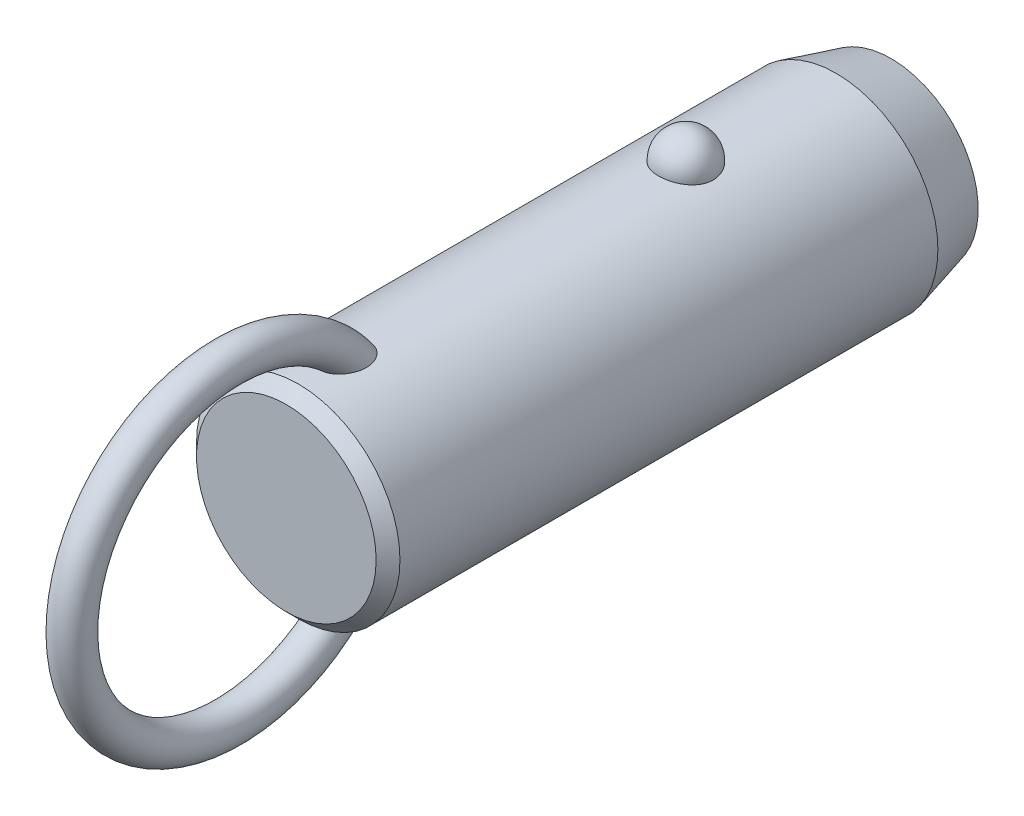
SolidWorks part; units mm, degrees
ref_plane "Front Plane" through (0, 0, 0) normal (0, 0, 1) x (1, 0, 0)
ref_plane "Top Plane" through (0, 0, 0) normal (0, 1, 0) x (1, 0, 0)
ref_plane "Right Plane" through (0, 0, 0) normal (1, 0, 0) x (0, 0, -1)
sketch "Sketch2" plane through (0, 0, 0) normal (0, 0, 1) x (1, 0, 0)
  circle A0 centre (0, 0) radius 11.1
  point P3 (0, 11.1)
  dimension "D1" = 22.2
extrude "Boss-Extrude1" add sketch "Sketch2" along normal blind 27.9
sketch "Sketch3" plane through (0, 0, 0) normal (0, 0, -1) x (-1, 0, 0)
  circle A0 centre (0, 0) radius 11.1
  dimension "D1" = 22.2
extrude "Boss-Extrude2" add sketch "Sketch3" along normal blind 25.4
chamfer "Chamfer1" distance 6 angle 15 1 edges at (-11.1, 0, -25.4)
sketch "Sketch12" plane through (0, 0, 0) normal (1, 0, 0) x (0, 0, -1)
  line L0 (-27.9, 11.1) -> (-27.9, -11.1) construction
  point P0 (-27.9, 0)
sketch "Sketch13" plane through (0, 0, 0) normal (1, 0, 0) x (0, 0, -1)
  circle A0 centre (-46.95, 0) radius 19.05
  point P2 (-27.9, 0)
  dimension "D1" = 38.1
sketch "Sketch14" plane through (0, 0, 0) normal (0, 1, 0) x (1, 0, 0)
  circle A0 centre (0, -29.9) radius 2
  point P2 (0, -27.9)
  dimension "D1" = 4
sweep "Sweep1" add profiles "Sketch14" path "Sketch13"
sketch "Sketch15" plane through (0, 0, 27.9) normal (0, 0, 1) x (1, 0, 0)
  circle A0 centre (0, 0) radius 11.1
  dimension "D1" = 22.2
extrude "Boss-Extrude3" add sketch "Sketch15" along normal blind 12.7
chamfer "Chamfer2" distance 1.3 angle 45 1 edges at (11.1, 0, 40.6)
sketch "Sketch18" plane through (0, 0, 0) normal (1, 0, 0) x (0, 0, -1)
  line L0 (19.4, 11.1) -> (-31.468, 11.1) construction
  line L1 (3, 14.1) -> (3, 8.1)
  line L2 (-31.468, -11.1) -> (19.4, -11.1) construction
  arc A0 (3, 14.1) -> (3, 8.1) centre (3, 11.1) ccw
  point P4 (0, 11.1)
  dimension "D1" = 25.2
revolve "Revolve1" add sketch "Sketch18" angle 360 about L1
